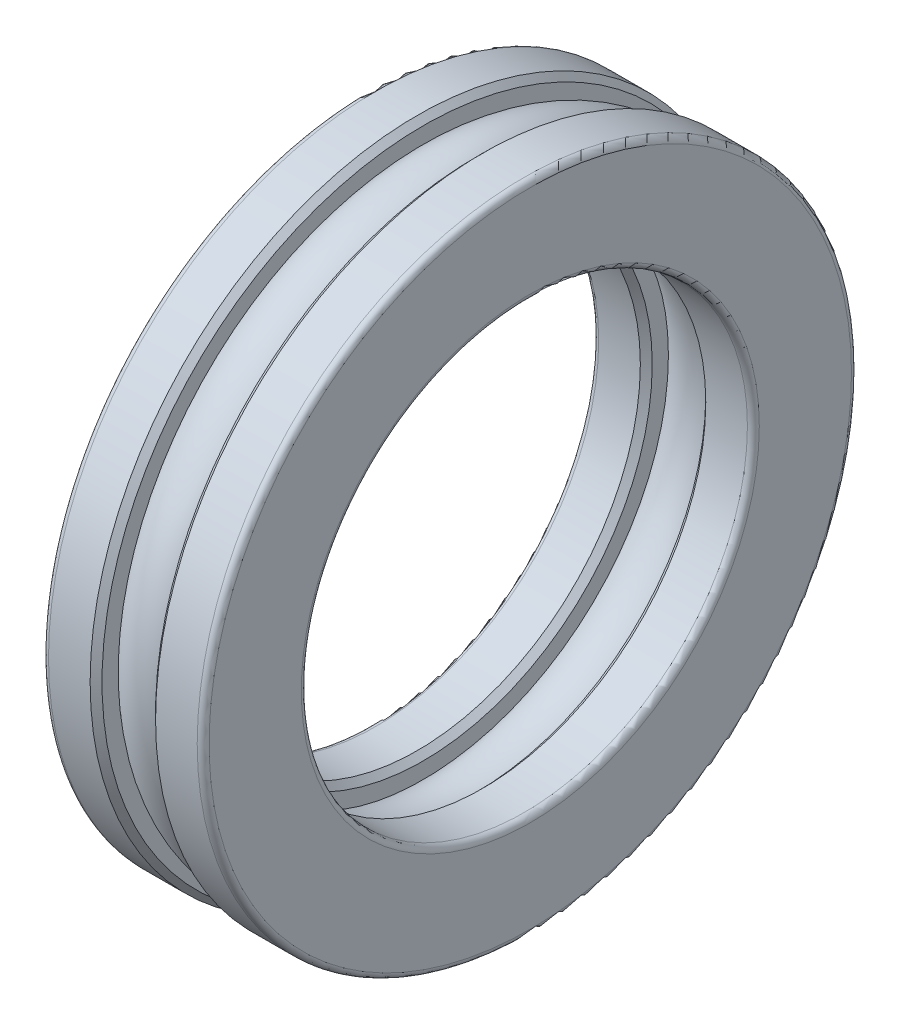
SolidWorks part; units mm, degrees
ref_plane "Plan de face" through (0, 0, 0) normal (0, 0, 1) x (1, 0, 0)
ref_plane "Plan de dessus" through (0, 0, 0) normal (0, 1, 0) x (1, 0, 0)
ref_plane "Plan de droite" through (0, 0, 0) normal (1, 0, 0) x (0, 0, -1)
sketch "Esquisse1" plane through (0, 0, 0) normal (0, 0, 1) x (1, 0, 0)
  line L0 (9, 38.5) -> (9, 41.2188)
  line L1 (9, 51.2812) -> (9, 54)
  line L2 (9, 54) -> (8, 55)
  line L3 (8, 55) -> (1, 55)
  line L4 (0, 54) -> (0, 38.5)
  line L5 (1, 37.5) -> (8, 37.5)
  line L6 (8, 37.5) -> (9, 38.5)
  line L7 (0, 0) -> (9, 0) construction
  arc A0 (9, 41.2188) -> (9, 51.2812) centre (13.5, 46.25) cw
  arc A1 (1, 55) -> (0, 54) centre (1, 54) ccw
  arc A2 (0, 38.5) -> (1, 37.5) centre (1, 38.5) ccw
  dimension "D3" = 1
  dimension "D5" = 1
  dimension "D6" = 6.75
  dimension "D1" = 17.5
  dimension "D2" = 9
  dimension "D4" = 46.25
  dimension "D7" = 8.75
  dimension "D8" = 45
  dimension "D9" = 1
  dimension "D10" = 45
  dimension "D11" = 1
  dimension "D12" = 13.5
  dimension "D13" = 13.5
revolve "Révolution1" add sketch "Esquisse1" angle 360 about L7
sketch "Esquisse2" plane through (0, 0, 0) normal (0, 0, 1) x (1, 0, 0)
  line L0 (6.75, 0) -> (20.25, 0) construction
  circle A0 centre (13.5, 46.25) radius 6.75
  dimension "D1" = 13.5
  dimension "D2" = 46.25
  dimension "D3" = 13.5
revolve "Révolution3" add sketch "Esquisse2" angle 360 about L0
ref_plane "Plan2" through (13.5, 0, 0) normal (1, 0, 0) x (0, 0, -1)
mirror "Symétrie2" about plane through (13.5, 0, 0) normal (1, 0, 0) of "Révolution1"
